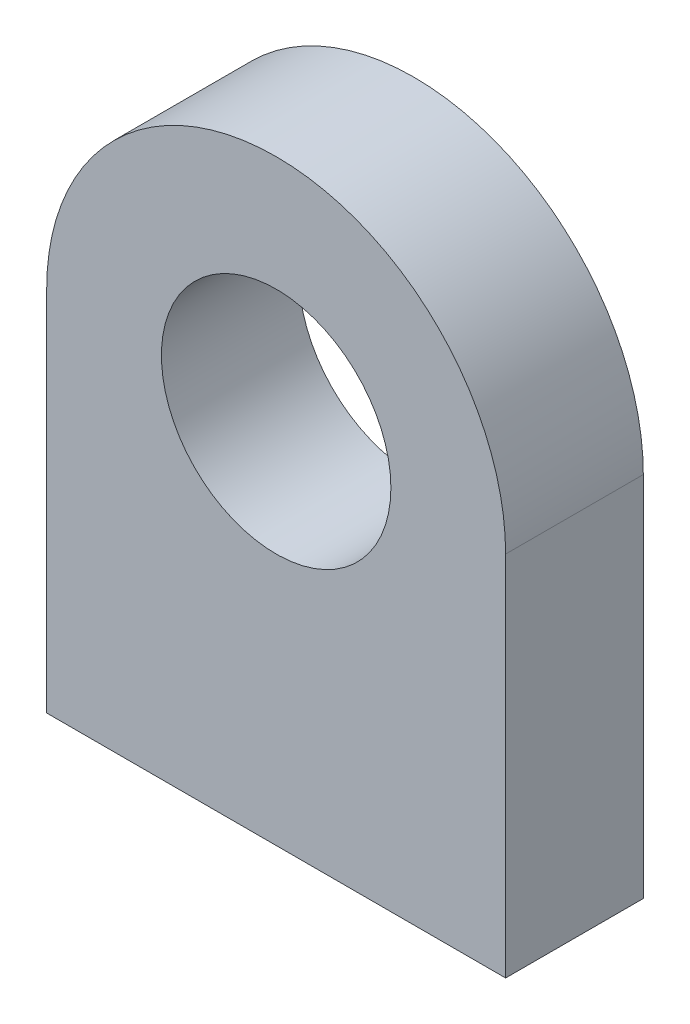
SolidWorks part; units mm, degrees
ref_plane "前视基准面" through (0, 0, 0) normal (0, 0, 1) x (1, 0, 0)
ref_plane "上视基准面" through (0, 0, 0) normal (0, 1, 0) x (1, 0, 0)
ref_plane "右视基准面" through (0, 0, 0) normal (1, 0, 0) x (0, 0, -1)
sketch "Sketch1" plane through (0, 0, 0) normal (0, 0, 1) x (1, 0, 0)
  line L0 (-50, 0) -> (-50, -80)
  line L1 (-50, -80) -> (50, -80)
  line L2 (50, -80) -> (50, 0)
  line L3 (0, 71.0543) -> (0, -117.2195) construction
  circle A0 centre (0, 0) radius 25
  arc A1 (-50, 0) -> (50, 0) centre (0, 0) cw
  dimension "D1" = 50
  dimension "D2" = 50
  dimension "D3" = 80
  dimension "D4" = 100
extrude "Extrude1" add sketch "Sketch1" along normal blind 30
